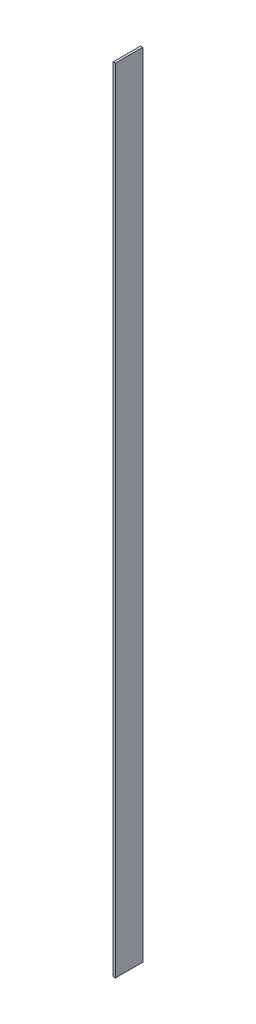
SolidWorks part; units mm, degrees
ref_plane "Front Plane" through (0, 0, 0) normal (1, 0, 0) x (0, 1, 0)
ref_plane "Top Plane" through (0, 0, 0) normal (0, 0, 1) x (0, 1, 0)
ref_plane "Right Plane" through (0, 0, 0) normal (0, 1, 0) x (-1, 0, 0)
sketch "Sketch1" plane through (0, 0, 0) normal (0, 0, 1) x (0, 1, 0)
  line L1 (-609.6, 1.5875) -> (609.6, 1.5875)
  line L2 (-609.6, 1.5875) -> (-609.6, -1.5875)
  line L3 (-609.6, -1.5875) -> (609.6, -1.5875)
  line L4 (609.6, 1.5875) -> (609.6, -1.5875)
  line L5 (-609.6, 1.5875) -> (609.6, -1.5875) construction
  line L6 (-609.6, -1.5875) -> (609.6, 1.5875) construction
  point P0 (0, 0)
  dimension "D1" = 3.175
  dimension "D2" = 1219.2
extrude "Boss-Extrude1" add sketch "Sketch1" along normal blind 38.1
sketch "Sketch2" plane through (0, 0, 0) normal (1, 0, 0) x (0, 1, 0)
  line L0 (-552.45, 154.1264) -> (552.45, 154.1264) construction
  line L2 (-552.45, 154.1264) -> (-703.2045, 154.1264)
  line L3 (-552.45, 154.1264) -> (-552.45, -72.1787)
  line L4 (-552.45, -72.1787) -> (-703.2045, -72.1787)
  line L5 (-703.2045, 154.1264) -> (-703.2045, -72.1787)
  line L6 (552.45, 154.1264) -> (666.9421, 154.1264)
  line L7 (552.45, 154.1264) -> (552.45, -90.6526)
  line L8 (552.45, -90.6526) -> (666.9421, -90.6526)
  line L9 (666.9421, 154.1264) -> (666.9421, -90.6526)
  point P2 (0, 154.1264)
  dimension "D1" = 1104.9
extrude "43.5in" cut sketch "Sketch2" against normal through all both and the other way through all
sketch "Sketch3" plane through (0, 0, 0) normal (1, 0, 0) x (0, 1, 0)
  line L0 (-571.5, 153.9976) -> (571.5, 153.9976) construction
  line L2 (-571.5, 153.9976) -> (-666.9083, 153.9976)
  line L3 (-571.5, 153.9976) -> (-571.5, -50.629)
  line L4 (-571.5, -50.629) -> (-666.9083, -50.629)
  line L5 (-666.9083, 153.9976) -> (-666.9083, -50.629)
  line L6 (571.5, 153.9976) -> (651.7963, 153.9976)
  line L7 (571.5, 153.9976) -> (571.5, -31.4826)
  line L8 (571.5, -31.4826) -> (651.7963, -31.4826)
  line L9 (651.7963, 153.9976) -> (651.7963, -31.4826)
  point P2 (0, 153.9976)
  dimension "D1" = 1143
extrude "Cut-Extrude1" [suppressed] cut sketch "Sketch3" against normal through all both and the other way through all
